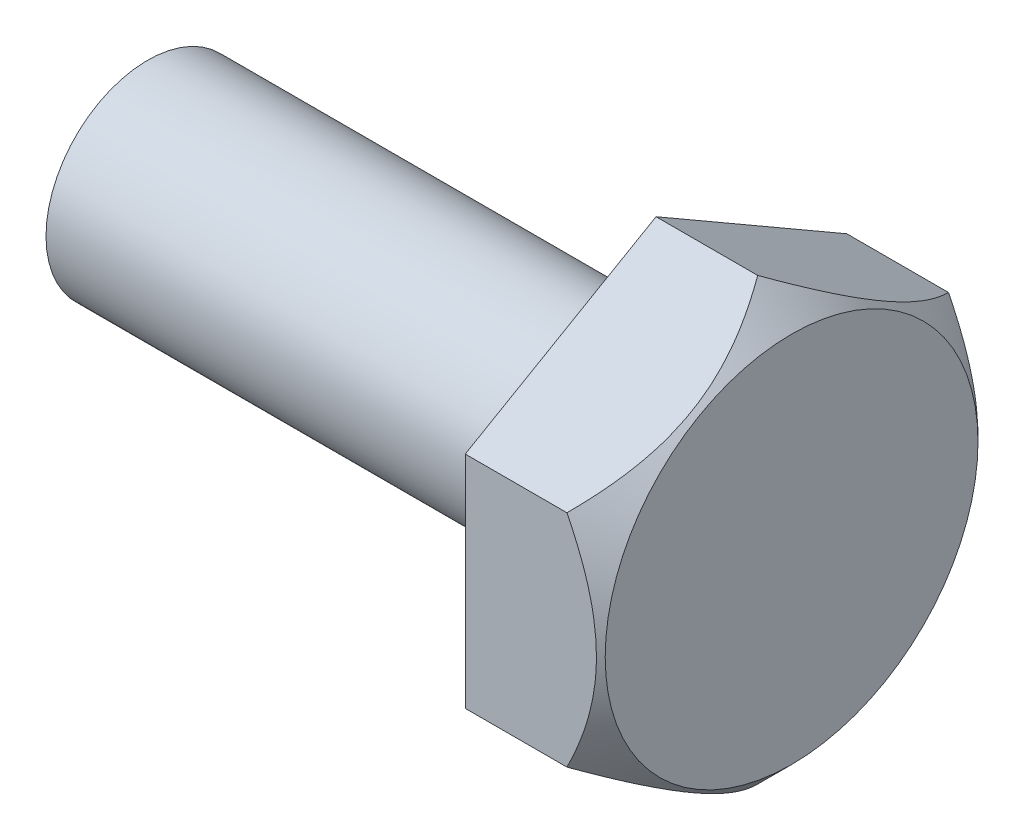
SolidWorks part; units mm, degrees
ref_plane "Plan de face" through (0, 0, 0) normal (0, 0, 1) x (1, 0, 0)
ref_plane "Plan de dessus" through (0, 0, 0) normal (0, 1, 0) x (1, 0, 0)
ref_plane "Plan de droite" through (0, 0, 0) normal (1, 0, 0) x (0, 0, -1)
sketch "Esquisse1" plane through (0, 0, 0) normal (0, 0, 1) x (1, 0, 0)
  line L0 (0, 0) -> (-19, 0)
  line L1 (-19, 0) -> (-19, 3)
  line L2 (-19, 3) -> (-4, 3)
  line L3 (-4, 3) -> (-4, 6.5)
  line L4 (-4, 6.5) -> (0, 6.5)
  line L5 (0, 6.5) -> (0, 0)
  line L6 (0, 0) -> (23.5029, 0) construction
  dimension "D1" = 6
  dimension "D2" = 15
  dimension "D3" = 4
  dimension "D4" = 13
revolve "Révolution1" add sketch "Esquisse1" angle 360 about L6
chamfer "Chanfrein1" distance 1 angle 45 1 edges at (0, 0, 6.5)
sketch "Esquisse2" plane through (0, 0, 0) normal (1, 0, 0) x (0, 0, -1)
  line L1 (0, 6.5) -> (-5.6292, 3.25)
  line L2 (-5.6292, 3.25) -> (-5.6292, -3.25)
  line L3 (-5.6292, -3.25) -> (0, -6.5)
  line L4 (0, -6.5) -> (5.6292, -3.25)
  line L5 (5.6292, -3.25) -> (5.6292, 3.25)
  line L6 (5.6292, 3.25) -> (0, 6.5)
  circle A0 centre (0, 0) radius 5.6292 construction
extrude "Enlèv. mat.-Extru.1" cut sketch "Esquisse2" against normal blind 10 flip side to cut
